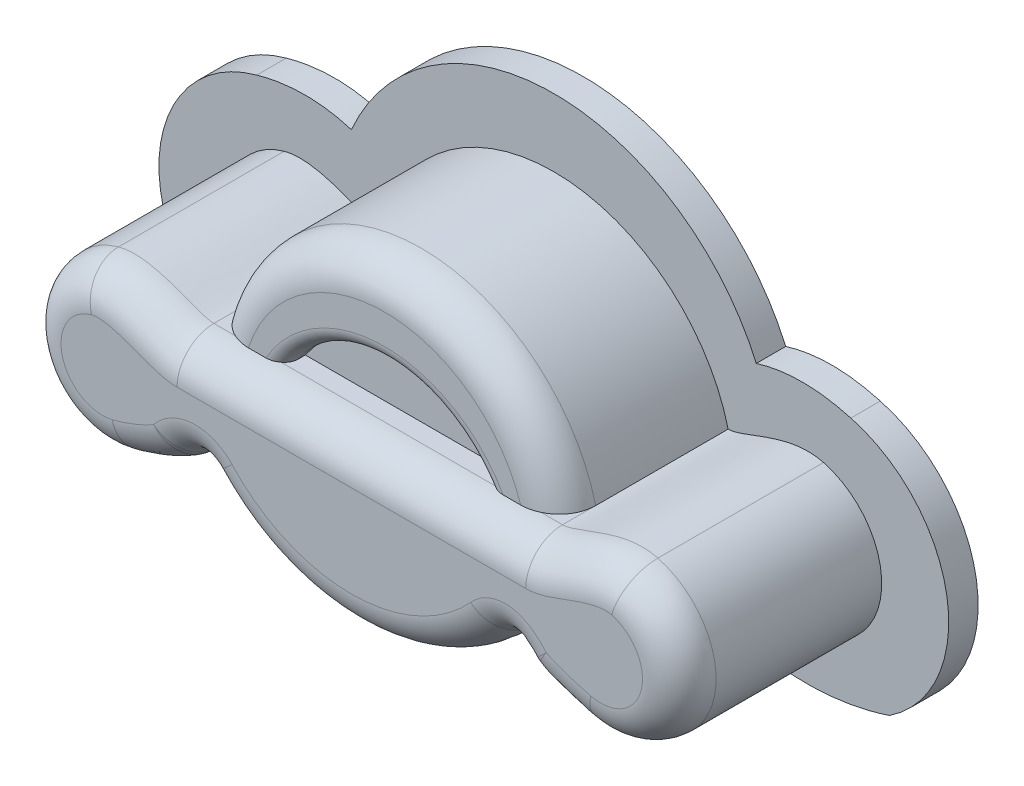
SolidWorks part; units mm, degrees
ref_plane "Front Plane" through (0, 0, 0) normal (0, 0, 1) x (1, 0, 0)
ref_plane "Top Plane" through (0, 0, 0) normal (0, 1, 0) x (1, 0, 0)
ref_plane "Right Plane" through (0, 0, 0) normal (1, 0, 0) x (0, 0, -1)
sketch "Sketch1" plane through (0, 0, 0) normal (0, 0, 1) x (1, 0, 0)
  line L0 (0, 9.144) -> (0, -6.096) construction
  line L1 (-13.589, 0) -> (13.589, 0) construction
  line L2 (-5.842, -3.81) -> (5.842, -3.81) construction
  line L3 (-13.589, 0) -> (-13.589, -8.6446) construction
  line L4 (-5.842, -3.81) -> (-19.5025, -3.81) construction
  line L5 (-6.985, 4.4129) -> (-20.5001, 4.4129) construction
  line L6 (-13.589, 0) -> (-13.589, 8.9506) construction
  line L7 (13.589, 8.9506) -> (13.589, -8.6446) construction
  line L8 (-11.5813, -3.81) -> (-8.7384, -4.7593) construction
  line L9 (-8.7384, -4.7593) -> (-5.842, -3.81) construction
  line L10 (-6.985, -8.6446) -> (-6.985, 8.9506) construction
  line L11 (6.985, -8.6446) -> (6.985, 9.3223) construction
  line L12 (-10.2497, 4.4129) -> (-8.5379, 4.8935) construction
  line L13 (-8.5379, 4.8935) -> (-6.985, 4.4129) construction
  line L14 (5.842, -3.81) -> (8.7384, -4.7593) construction
  line L15 (8.7384, -4.7593) -> (11.5813, -3.81) construction
  line L16 (5.842, -3.81) -> (19.1237, -3.81) construction
  line L17 (6.985, 4.4129) -> (18.5459, 4.4129) construction
  line L18 (6.985, 4.4129) -> (8.5379, 4.8935) construction
  line L19 (8.5379, 4.8935) -> (10.2497, 4.4129) construction
  arc A0 (-5.842, -3.81) -> (5.842, -3.81) centre (0, 2.5502) ccw
  arc A1 (-11.5813, -3.81) -> (-10.2497, 4.4129) centre (-9.054, 0) cw
  arc A2 (11.5813, -3.81) -> (10.2497, 4.4129) centre (9.054, 0) ccw
  arc A3 (-6.985, 4.4129) -> (6.985, 4.4129) centre (0, 1.3675) cw
  spline S0 degree 2 poles (-11.5813, -3.81) (-8.7384, -4.7593) (-5.842, -3.81) knots 0 0 0 1 1 1
  spline S1 degree 2 poles (-10.2497, 4.4129) (-8.5379, 4.8935) (-6.985, 4.4129) knots 0 0 0 1 1 1
  spline S2 degree 2 poles (5.842, -3.81) (8.7384, -4.7593) (11.5813, -3.81) knots 0 0 0 1 1 1
  spline S3 degree 2 poles (6.985, 4.4129) (8.5379, 4.8935) (10.2497, 4.4129) knots 0 0 0 1 1 1
  dimension "D7" = 9.144
  dimension "D8" = 8.636
  dimension "D9" = 2.9972
  dimension "D15" = 3.048
  dimension "D20" = 5.8423
  dimension "D21" = 4.572
  dimension "D23" = 1.778
  dimension "D11" = 1.778
  dimension "D18" = 7.62
  dimension "D19" = 2.9972
  dimension "D5" = 4.572
  dimension "D13" = 5.8423
  dimension "D14" = 3.3114
  dimension "D1" = 15.24
  dimension "D2" = 2.286
  dimension "D3" = 27.178
  dimension "D4" = 11.684
  dimension "D6" = 13.589
  dimension "D10" = 3.048
  dimension "D12" = 1.6256
  dimension "D16" = 13.97
  dimension "D17" = 6.985
  dimension "D22" = 1.6256
extrude "Boss-Extrude1" add sketch "Sketch1" along normal blind 1.016
sketch "Sketch2" plane through (0, 0, 1.016) normal (0, 0, 1) x (1, 0, 0)
  line L0 (-13.626, 0) -> (13.626, 0) construction
  line L1 (-9.307, 2.6067) -> (-8.0832, 2.9461) construction
  line L2 (-11.2892, 0) -> (-5.879, 0) construction
  line L3 (5.879, 0) -> (11.2892, 0) construction
  line L4 (5.0546, -1.526) -> (5.2726, -1.2883) construction
  line L5 (5.4267, -1.3277) -> (5.8228, -1.7572) construction
  line L6 (-6.0162, 1.965) -> (6.0145, 1.965)
  line L7 (0, 8.9875) -> (0, -6.0858) construction
  line L8 (-5.0546, -1.526) -> (5.0546, -1.526) construction
  line L9 (0, 3.109) -> (0, -3.7744) construction
  line L10 (-7.9633, -2.6329) -> (-7.2895, -2.474) construction
  line L11 (-5.8741, -1.6642) -> (-5.51, -1.2073) construction
  line L12 (-5.1482, -1.4239) -> (-5.0546, -1.526) construction
  line L13 (-5.51, -1.2073) -> (-5.1482, -1.4239) construction
  line L14 (-6.159, -2.0218) -> (-5.8741, -1.6642) construction
  line L15 (-8.0832, 2.9461) -> (-6.6004, 1.965) construction
  line L16 (-6.6004, 1.965) -> (-6.0162, 1.965) construction
  line L17 (-7.2895, -2.474) -> (-6.159, -2.0218) construction
  line L18 (5.8228, -1.7572) -> (6.1328, -2.0933) construction
  line L19 (6.1328, -2.0933) -> (7.0419, -2.3985) construction
  line L20 (-8.5841, 0) -> (-11.2892, 0) construction
  line L21 (0, 3.109) -> (0, -3.749) construction
  line L22 (5.2726, -1.2883) -> (5.4267, -1.3277) construction
  line L23 (6.0145, 1.965) -> (6.5993, 1.965) construction
  line L24 (6.5993, 1.965) -> (8.0786, 2.9363) construction
  line L25 (8.0786, 2.9363) -> (9.3069, 2.6135) construction
  line L26 (8.6091, 0) -> (11.2892, 0) construction
  line L27 (7.0419, -2.3985) -> (7.9581, -2.6256) construction
  arc A0 (-10.2497, 4.4129) -> (-11.5813, -3.81) centre (-9.054, 0) ccw construction
  arc A1 (11.5813, -3.81) -> (10.2497, 4.4129) centre (9.054, 0) ccw construction
  arc A4 (-9.307, 2.6067) -> (-7.9633, -2.6329) centre (-8.5841, 0) ccw
  arc A5 (6.985, 4.4129) -> (-6.985, 4.4129) centre (0, 1.3675) ccw construction
  arc A6 (-5.842, -3.81) -> (5.842, -3.81) centre (0, 2.5502) ccw construction
  arc A8 (-5.0546, -1.526) -> (5.0546, -1.526) centre (0, 3.109) ccw
  arc A9 (9.3069, 2.6135) -> (7.9581, -2.6256) centre (8.6091, 0) cw
  spline S0 degree 3 poles (-5.8741, -1.6642) (-5.51, -1.2073) (-5.1482, -1.4239) (-5.0546, -1.526) knots 0 0 0 0 1 1 1 1
  spline S1 degree 3 poles (-7.9633, -2.6329) (-7.2895, -2.474) (-6.159, -2.0218) (-5.8741, -1.6642) knots 0 0 0 0 1 1 1 1
  spline S2 degree 3 poles (-9.307, 2.6067) (-8.0832, 2.9461) (-6.6004, 1.965) (-6.0162, 1.965) knots 0 0 0 0 1 1 1 1
  spline S3 degree 3 poles (5.0546, -1.526) (5.2726, -1.2883) (5.4267, -1.3277) (5.8228, -1.7572) knots 0 0 0 0 1 1 1 1
  spline S4 degree 3 poles (5.8228, -1.7572) (6.1328, -2.0933) (7.0419, -2.3985) (7.9581, -2.6256) knots 0 0 0 0 1 1 1 1
  spline_without_curve S5
  dimension "D9" = 2.3368
  dimension "D15" = 2.7051
  dimension "D6" = 2.3266
  dimension "D21" = 2.3266
  dimension "D22" = 3.4036
  dimension "D24" = 6.858
  dimension "D26" = 0.9525
  dimension "D27" = 0.9525
  dimension "D32" = 2.7051
  dimension "D4" = 2.3368
  dimension "D5" = 3.3528
  dimension "D7" = 1.27
  dimension "D10" = 10.1092
  dimension "D11" = 1.905
  dimension "D12" = 0.4572
  dimension "D13" = 0.4216
  dimension "D14" = 0.5842
  dimension "D16" = 1.778
  dimension "D17" = 0.5842
  dimension "D18" = 0.5842
  dimension "D19" = 0.4572
  dimension "D23" = 2.3368
extrude "Boss-Extrude2" add sketch "Sketch2" along normal blind 6.985
sketch "Sketch3" plane through (0, 0, 1.016) normal (0, 0, 1) x (1, 0, 0)
  line L0 (0, 8.9875) -> (-0.0008, 1.965) construction
  line L1 (6.0145, 1.965) -> (-6.0162, 1.965) construction
  line L2 (-3.4933, 1.965) -> (3.4917, 1.965)
  line L3 (6.0145, 1.965) -> (-6.0162, 1.965) construction
  line L4 (-0.0008, 1.965) -> (-0.0008, -14.8031) construction
  arc A0 (6.985, 4.4129) -> (-6.985, 4.4129) centre (0, 1.3675) ccw construction
  arc A1 (-3.4933, 1.965) -> (3.4917, 1.965) centre (-0.0008, -0.3517) cw
  dimension "D3" = 4.191
  dimension "D1" = 3.4925
  dimension "D2" = 6.985
extrude "Boss-Extrude3" add sketch "Sketch3" along normal blind 5.08 contours A1 M11
sketch "Sketch4" plane through (0, 0, 1.016) normal (0, 0, 1) x (1, 0, 0)
  line L0 (0, 8.9875) -> (0, -10.5682) construction
  line L1 (6.0145, 1.965) -> (-6.0162, 1.965) construction
  line L2 (0, -0.3504) -> (0, 6.6507) construction
  line L3 (-6.0162, 1.965) -> (-3.4933, 1.965)
  line L4 (3.4933, 1.965) -> (6.0162, 1.965)
  arc A1 (6.985, 4.4129) -> (-6.985, 4.4129) centre (0, 1.3675) ccw construction
  arc A2 (-3.4933, 1.965) -> (3.4933, 1.965) centre (0, -0.3504) cw
  arc A4 (-6.0162, 1.965) -> (6.0162, 1.965) centre (0, 0.4457) cw
  spline S0 degree 3 poles (9.3069, 2.6135) (8.0786, 2.9363) (6.5993, 1.965) (6.0145, 1.965) knots 0 0 0 0 1 1 1 1 construction
  dimension "D1" = 4.191
  dimension "D2" = 2.3368
extrude "Boss-Extrude4" add sketch "Sketch4" along normal blind 5.842
fillet "Fillet2" radius 1.27 1 edges
fillet "Fillet4" radius 1.27 8 edges at (0, -3.749, 8.001) (11.2287, -0.6744, 8.001) (-0.0008, 1.965, 8.001) (-11.2044, -0.672, 8.001)
fillet "Fillet5" radius 0.508 1 edges at (0, 3.8406, 6.858)
sketch "Sketch5" plane through (0, 0, 0) normal (0, 0, -1) x (-1, 0, 0)
  line L0 (-13.626, 0) -> (13.626, 0) construction
  line L1 (0, 0) -> (0, -6.0858) construction
  arc A0 (11.5813, -3.81) -> (10.2497, 4.4129) centre (9.054, 0) ccw construction
  arc A2 (-13.626, 0) -> (-11.5813, -3.81) centre (-9.054, 0) ccw
  arc A3 (-5.842, -3.81) -> (5.842, -3.81) centre (0, 2.5502) ccw construction
  arc A5 (0, -6.0858) -> (-5.842, -3.81) centre (0, 2.5502) cw
  point P8 (0, 0)
  dimension "D1" = 2.0447
  dimension "D2" = 5.842
